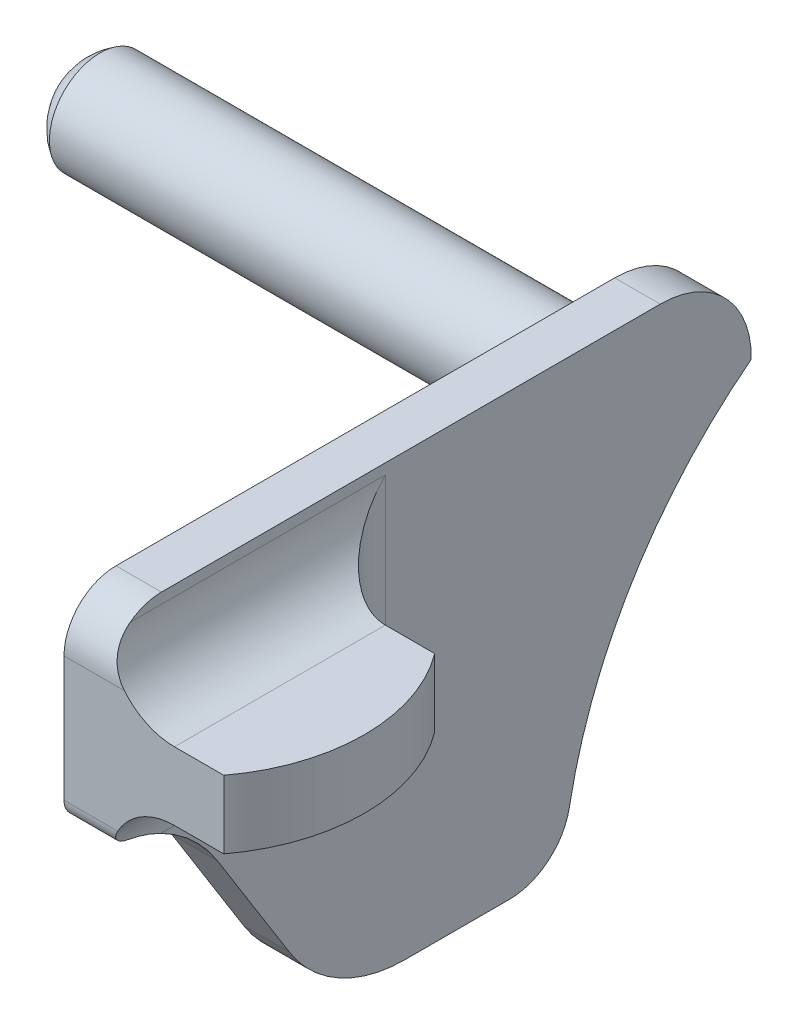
SolidWorks part; units mm, degrees
ref_plane "Front Plane" through (0, 0, 0) normal (0, 0, 1) x (1, 0, 0)
ref_plane "Top Plane" through (0, 0, 0) normal (0, 1, 0) x (1, 0, 0)
ref_plane "Right Plane" through (0, 0, 0) normal (1, 0, 0) x (0, 0, -1)
sketch "Sketch1" plane through (0, 0, 0) normal (1, 0, 0) x (0, 0, -1)
  line L0 (-10.3629, 13.4021) -> (9.1281, 13.4021)
  line L1 (-0.8375, -3.7986) -> (3.2309, -3.7986)
  line L2 (-8.1859, 3.2297) -> (-5.361, -1.2912)
  line L3 (-12.3949, 11.3701) -> (-12.3949, 6.4857)
  arc A0 (12.6829, 9.7533) -> (5.578, -1.8486) centre (24.3053, -5.3405) ccw
  arc A1 (11.7637, 12.2333) -> (3.7027, 1.1142) centre (24.3053, -5.3405) ccw construction
  arc A2 (9.1281, 13.4021) -> (12.6827, 9.7459) centre (9.1281, 9.8461) cw
  arc A3 (-8.1859, 3.2297) -> (-11.7879, 5.7396) centre (-12.9248, 0.2685) ccw
  arc A4 (5.578, -1.8486) -> (3.2309, -3.7986) centre (3.2309, -1.411) cw
  arc A5 (-0.8375, -3.7986) -> (-5.361, -1.2912) centre (-0.8375, 1.5354) cw
  arc A6 (-12.3949, 6.4857) -> (-11.7879, 5.7396) centre (-11.6329, 6.4857) ccw
  arc A7 (-10.3629, 13.4021) -> (-12.3949, 11.3701) centre (-10.3629, 11.3701) ccw
  arc A8 (-3.1462, 0.572) -> (0.6866, -3.1232) centre (0, 0) ccw construction
  arc A9 (1.0196, 3.0308) -> (-3.1462, 0.572) centre (-1.6268, 2.7561) ccw construction
  arc A10 (0.6866, -3.1232) -> (2.622, 1.8305) centre (1.7368, -0.6785) ccw construction
  circle A11 centre (8.8271, 9.2804) radius 1.9787 construction
  arc A12 (2.622, 1.8305) -> (1.0196, 3.0308) centre (0, 0) ccw construction
  arc A13 (2.8315, -3.1035) -> (2.7704, -3.7986) centre (24.3053, -5.3405) ccw
  dimension "D3" = 3.556
  dimension "D4" = 58
  dimension "D1" = 38.1
  dimension "D2" = 43.18
  dimension "D5" = 11.176
  dimension "D6" = 2.3876
  dimension "D7" = 5.334
  dimension "D8" = 0.762
  dimension "D9" = 2.032
extrude "Boss-Extrude1" add sketch "Sketch1" along normal blind 1.778
sketch "Sketch2" plane through (1.778, 0, 0) normal (1, 0, 0) x (0, 0, -1)
  line L4 (-0.8375, -3.7986) -> (3.2309, -3.7986)
  line L5 (9.1281, 13.4021) -> (-10.3629, 13.4021)
  line L6 (-12.3949, 11.3701) -> (-12.3949, 6.4857)
  line L7 (-8.1859, 3.2297) -> (-5.361, -1.2912)
  line L8 (-0.8375, -3.7986) -> (3.2309, -3.7986)
  line L9 (9.1281, 13.4021) -> (-10.3629, 13.4021)
  line L10 (-12.3949, 11.3701) -> (-12.3949, 6.4857)
  line L11 (-8.1859, 3.2297) -> (-5.361, -1.2912)
  arc A0 (2.7037, 1.8002) -> (2.622, 1.8305) centre (1.7368, -0.6785) ccw
  arc A4 (3.2482, -0.0033) -> (-2.3139, 2.2796) centre (0, 0) ccw
  arc A7 (3.2309, -3.7986) -> (5.578, -1.8486) centre (3.2309, -1.411) ccw
  arc A8 (12.6829, 9.7533) -> (5.578, -1.8486) centre (24.3053, -5.3405) ccw
  arc A9 (12.6829, 9.7533) -> (9.1281, 13.4021) centre (9.1281, 9.8461) ccw
  arc A10 (-10.3629, 13.4021) -> (-12.3949, 11.3701) centre (-10.3629, 11.3701) ccw
  arc A11 (-12.3949, 6.4857) -> (-11.7879, 5.7396) centre (-11.6329, 6.4857) ccw
  arc A12 (-8.1859, 3.2297) -> (-11.7879, 5.7396) centre (-12.9248, 0.2685) ccw
  arc A13 (-5.361, -1.2912) -> (-0.8375, -3.7986) centre (-0.8375, 1.5354) ccw
  arc A14 (3.2309, -3.7986) -> (5.578, -1.8486) centre (3.2309, -1.411) ccw
  arc A15 (12.6829, 9.7533) -> (5.578, -1.8486) centre (24.3053, -5.3405) ccw
  arc A16 (12.6829, 9.7533) -> (9.1281, 13.4021) centre (9.1281, 9.8461) ccw
  arc A17 (-10.3629, 13.4021) -> (-12.3949, 11.3701) centre (-10.3629, 11.3701) ccw
  arc A18 (-12.3949, 6.4857) -> (-11.7879, 5.7396) centre (-11.6329, 6.4857) ccw
  arc A19 (-8.1859, 3.2297) -> (-11.7879, 5.7396) centre (-12.9248, 0.2685) ccw
  arc A20 (-5.361, -1.2912) -> (-0.8375, -3.7986) centre (-0.8375, 1.5354) ccw
  arc A22 (3.2482, -0.0033) -> (1.2958, -1.3635) centre (6.7283, -7.0801) ccw
  arc A23 (-1.8801, -0.0585) -> (1.2958, -1.3635) centre (0, 0) ccw
  arc A24 (-1.8801, -0.0585) -> (-2.3139, 2.2796) centre (-9.7096, -0.3019) ccw
  dimension "D1" = 0
extrude "Boss-Extrude2" add sketch "Sketch2" against normal blind 3.5306 contours A23 A22 A4 A24
sketch "Sketch3" plane through (0, 0, 0) normal (-1, 0, 0) x (0, 0, 1)
  line L0 (0, 0) -> (18.4927, 0) construction
  line L1 (0, 0) -> (22.6326, 18.991) construction
  line L2 (22.6326, 18.991) -> (26.4118, 14.487) construction
  line L3 (1.9924, 1.0418) -> (-1.0825, -1.5383)
  arc A3 (-1.2958, -1.3635) -> (1.8801, -0.0585) centre (0, 0) ccw construction
  arc A4 (-1.0825, -1.5383) -> (1.8801, -0.0585) centre (0, 0) ccw
  arc A5 (1.9924, 1.0418) -> (1.8801, -0.0585) centre (9.7096, -0.3019) ccw
  dimension "D1" = 40
  dimension "D2" = 0.4826
sketch3d "3DSketch1"
  line L0 (0, 14.487, 26.4118) -> (-9.1625, 14.487, 26.4118) construction
ref_plane "Plane1" through (0, 18.991, 22.6326) normal (0, -0.6428, -0.766) x (-1, 0, 0)
sketch "Sketch4" plane through (-1.7526, 0, 0) normal (-1, 0, 0) x (0, 0, 1)
  circle A0 centre (0, 0) radius 3.1978
sketch "Sketch5" plane through (1.778, 0, 0) normal (1, 0, 0) x (0, 0, -1)
  arc A0 (2.9335, -0.9984) -> (-2.7926, 1.3432) centre (0, 0) ccw
  arc A1 (2.9335, -0.9984) -> (0.8477, -2.9806) centre (6.474, -6.8125) ccw
  arc A2 (-2.7006, -1.5196) -> (-2.7926, 1.3432) centre (-9.398, -0.3019) ccw
  arc A3 (-2.7006, -1.5196) -> (0.8477, -2.9806) centre (0, 0) ccw
  dimension "D1" = 6.1976
  dimension "D2" = 9.398
  dimension "D3" = 13.6144
  dimension "D4" = 9.398
extrude "Boss-Extrude3" add sketch "Sketch5" against normal blind 9.5758
sketch "Sketch6" plane through (0, 18.991, 22.6326) normal (0, -0.6428, -0.766) x (-1, 0, 0)
  line L0 (3.302, -1.7632) -> (3.302, -4.6755) construction
  line L1 (0, -3.4482) -> (0, -0.8331) construction
  line L2 (1.7526, -2.4149) -> (1.7526, -5.4494) construction
  line L3 (0, -3.4482) -> (0, -4.6961) construction
  dimension "D1" = 3.302
  dimension "D2" = 1.7526
sketch "Sketch8" plane through (0, 0, 0) normal (-1, 0, 0) x (0, 0, 1)
  line L1 (0, 0) -> (13.6415, 0) construction
  line L2 (0, 0) -> (22.6326, 18.991) construction
  line L3 (0, 0) -> (22.6326, 18.991) construction
  line L4 (2.6551, 1.5979) -> (-1.6474, -2.0123)
  arc A0 (-0.8477, -2.9806) -> (2.7006, -1.5196) centre (0, 0) ccw construction
  arc A1 (-0.8477, -2.9806) -> (2.7006, -1.5196) centre (0, 0) ccw
  arc A2 (2.7926, 1.3432) -> (2.7006, -1.5196) centre (9.398, -0.3019) ccw construction
  arc A3 (2.7926, 1.3432) -> (2.7006, -1.5196) centre (9.398, -0.3019) ccw
  arc A4 (-0.8477, -2.9806) -> (-2.9335, -0.9984) centre (-6.474, -6.8125) ccw construction
  arc A5 (-0.8477, -2.9806) -> (-1.6474, -2.0123) centre (-6.474, -6.8125) ccw
  arc A6 (2.7926, 1.3432) -> (2.2601, 2.12) centre (0, 0) ccw construction
  arc A7 (2.7926, 1.3432) -> (2.6551, 1.5979) centre (0, 0) ccw
  dimension "D1" = 0.4826
extrude "Cut-Extrude1" cut sketch "Sketch8" along normal blind 1.7526
sketch "Sketch10" plane through (-7.7978, 0, 0) normal (-1, 0, 0) x (0, 0, 1)
  line L0 (2.6045, 0.1297) -> (-0.9418, -2.846)
  line L1 (0, 0) -> (22.6326, 18.991) construction
  arc A0 (-0.8477, -2.9806) -> (2.7006, -1.5196) centre (0, 0) ccw construction
  arc A1 (-0.8477, -2.9806) -> (2.7006, -1.5196) centre (0, 0) ccw
  arc A2 (2.7926, 1.3432) -> (2.7006, -1.5196) centre (9.398, -0.3019) ccw construction
  arc A3 (2.6045, 0.1297) -> (2.7006, -1.5196) centre (9.398, -0.3019) ccw
  arc A4 (-0.8477, -2.9806) -> (-2.9335, -0.9984) centre (-6.474, -6.8125) ccw construction
  arc A5 (-0.8477, -2.9806) -> (-0.9418, -2.846) centre (-6.474, -6.8125) ccw
  dimension "D1" = 1.5748
sketch3d "3DSketch3"
  line L0 (-7.7978, 0.1297, 2.6045) -> (-5.842, 0.1297, 2.6045)
  line L1 (-3.302, -2.4103, 2.6045) -> (-3.302, -2.4812, 2.6045)
  line L2 (-3.302, -2.4812, 2.6045) -> (-7.7978, -2.4812, 2.6045)
  line L3 (-7.7978, 0.1297, 2.6045) -> (-7.7978, -2.4812, 2.6045)
  arc A0 (-5.842, 0.1297, 2.6045) -> (-3.302, -2.4103, 2.6045) centre (-5.842, -2.4103, 2.6045) ccw
  point P8 (-3.302, 0.1297, 2.6045)
  point P9 (-5.842, -2.4103, 0.0645)
  dimension "D2" = 2.54
  dimension "D1" = 3.302
sketch "Sketch11" plane through (0, 18.991, 22.6326) normal (0, -0.6428, -0.766) x (-1, 0, 0)
  line L0 (3.302, -3.5748) -> (7.7978, -3.5748) construction
  line L1 (3.302, -3.5748) -> (7.7978, -3.5748)
  line L2 (7.7978, -1.5748) -> (5.842, -1.5748) construction
  line L3 (7.7978, -1.5748) -> (5.842, -1.5748)
  line L4 (7.7978, -1.5748) -> (7.7978, -3.5748)
  ellipse E0 centre (5.842, -3.5206) end of major axis (8.382, -3.5206) minor radius 1.9458 (5.842, -1.5748) -> (3.302, -3.5206) ccw construction
  ellipse E1 centre (5.842, -3.5206) end of major axis (8.382, -3.5206) minor radius 1.9458 (5.842, -1.5748) -> (3.303, -3.5748) ccw
extrude "Cut-Extrude6" cut sketch "Sketch11" along normal through all contours L3 E1 L1 L4
sketch3d "3DSketch4"
  line L0 (0, 9.2804, -8.8271) -> (-20.955, 9.2804, -8.8271) construction
  line L1 (-20.955, 9.2804, -8.8271) -> (-20.955, 5.515, -8.8271) construction
  line L2 (-18.669, 9.2804, -8.8271) -> (-18.669, 6.9944, -8.8271) construction
  line L3 (-18.669, 9.2804, -8.8271) -> (-18.669, 11.5664, -8.8271) construction
  circle A0 centre (-18.669, 9.2804, -8.8271) radius 2.286
  point P6 (-18.669, 9.2804, -6.5411)
  dimension "D2" = 4.572
  dimension "D1" = 20.955
ref_plane "Plane2" through (0, 0, -8.8271) normal (0, 0, 1) x (1, 0, 0)
sketch "Sketch13" plane through (0, 0, -8.8271) normal (0, 0, 1) x (1, 0, 0)
  line L1 (-18.669, 6.9944) -> (-18.669, 11.5664) construction
  line L2 (-18.669, 6.9944) -> (-18.669, 11.5664)
  circle A0 centre (-18.669, 9.2804) radius 2.286 construction
  arc A1 (-18.669, 11.5664) -> (-18.669, 6.9944) centre (-18.669, 9.2804) ccw
revolve "Revolve1" add sketch "Sketch13" angle 90 about L1
sketch "Sketch14" plane through (0, 0, 0) normal (-1, 0, 0) x (0, 0, 1)
  circle A0 centre (-8.8271, 9.2804) radius 1.9787 construction
  circle A1 centre (-8.8271, 9.2804) radius 1.9787
extrude "Boss-Extrude4" add sketch "Sketch14" along normal up to surface (18.669 mm away)
sketch "Sketch15" plane through (0, 0, 0) normal (-1, 0, 0) x (0, 0, 1)
  circle A0 centre (-8.8271, 9.2804) radius 1.9787 construction
  circle A1 centre (-8.8271, 9.2804) radius 1.9787
  circle A2 centre (-8.8271, 9.2804) radius 2.6186
extrude "Cut-Extrude8" cut sketch "Sketch15" along normal up to vertex
sketch "Sketch17" plane through (-7.7978, 0, 0) normal (-1, 0, 0) x (0, 0, 1)
  line L0 (0, 0) -> (17.438, 0) construction
  line L1 (0, 0) -> (11.2328, -10.2211) construction
  line L2 (11.2328, -10.2211) -> (9.063, -12.6057) construction
  line L3 (0, 0) -> (4.6913, 5.1556) construction
  dimension "D1" = 42.3
sketch3d "3DSketch5"
  line L0 (-7.7978, 5.1556, 4.6913) -> (-5.2276, 5.1556, 4.6913) construction
ref_plane "Plane3" through (0, 0, 0) normal (0, 0.673, -0.7396) x (-1, 0, 0)
sketch "Sketch18" plane through (0, 0, 0) normal (0, 0.673, -0.7396) x (-1, 0, 0)
  line L2 (0, 0) -> (11.0801, 0) construction
  line L3 (7.9957, 1.4732) -> (6.096, 1.4732)
  line L4 (3.4777, 3.2921) -> (7.9957, 3.2921)
  line L5 (7.9957, 3.2921) -> (7.9957, 1.4732)
  arc A0 (3.4777, 3.2921) -> (6.096, 1.4732) centre (6.096, 4.2672) ccw
  dimension "D2" = 5.588
  dimension "D3" = 1.4732
extrude "Cut-Extrude9" cut sketch "Sketch18" along normal blind 6.096
sketch "Sketch19" plane through (0, 0, 0) normal (0, 0.673, -0.7396) x (-1, 0, 0)
  line L3 (7.7978, 1.4732) -> (7.7978, 3.0988)
  line L4 (7.7978, 3.0988) -> (3.558, 3.0988)
  line L5 (6.096, 1.4732) -> (7.7978, 1.4732)
  line L6 (7.7978, 1.4732) -> (7.7978, 3.0988)
  line L7 (7.7978, 3.0988) -> (3.558, 3.0988)
  line L8 (6.096, 1.4732) -> (7.7978, 1.4732)
  arc A1 (3.558, 3.0988) -> (6.096, 1.4732) centre (6.096, 4.2672) ccw
  arc A2 (3.558, 3.0988) -> (6.096, 1.4732) centre (6.096, 4.2672) ccw
  dimension "D1" = 0
extrude "Cut-Extrude10" cut sketch "Sketch19" against normal blind 6.096
sketch "Sketch20" plane through (1.778, 0, 0) normal (1, 0, 0) x (0, 0, -1)
sketch "Sketch21" plane through (1.778, 0, 0) normal (1, 0, 0) x (0, 0, -1)
  line L0 (-12.3949, 11.3701) -> (-12.3949, 6.4857) construction
  line L1 (-12.3949, 10.4501) -> (-4.1544, 10.4501)
  line L2 (-12.3949, 10.4501) -> (-12.3949, 7.789)
  line L3 (-12.3949, 7.789) -> (-4.1544, 7.789)
  line L4 (-4.1544, 10.4501) -> (-4.1544, 7.789)
extrude "Boss-Extrude5" add sketch "Sketch21" along normal blind 5.842
fillet "Fillet1" radius 2.54 3 edges at (1.778, 9.1196, 4.1544)
sketch "Sketch22" plane through (0, 10.4501, 0) normal (0, 1, 0) x (1, 0, 0)
  line L0 (7.62, -8.2746) -> (-2.4479, -8.2746) construction
  line L1 (7.62, -4.1544) -> (7.62, -12.3949) construction
  line L2 (7.62, -4.1544) -> (7.62, -8.2746) construction
  line L3 (7.62, -4.1544) -> (6.2443, -4.1544)
  line L4 (7.62, -8.2746) -> (7.62, -4.1544)
  arc A0 (7.62, -8.2746) -> (6.2443, -4.1544) centre (0.762, -8.2746) ccw
  dimension "D1" = 13.716
extrude "Cut-Extrude14" cut sketch "Sketch22" against normal blind 5.842
sketch "Sketch23" plane through (0, 10.4501, 0) normal (0, 1, 0) x (1, 0, 0)
  line L1 (7.62, -8.2746) -> (7.62, -4.1544) construction
  line L3 (7.62, -12.3949) -> (7.62, -8.2746)
  line L6 (7.62, -8.2746) -> (3.9428, -8.2746) construction
  line L7 (7.62, -12.3949) -> (6.2443, -12.3949)
  arc A0 (7.62, -8.2746) -> (6.2443, -4.1544) centre (0.762, -8.2746) ccw construction
  arc A1 (6.2443, -12.3949) -> (7.62, -8.2746) centre (0.762, -8.2746) ccw
extrude "Cut-Extrude15" cut sketch "Sketch23" against normal blind 5.842
sketch "Sketch25" plane through (0, 0, 0) normal (-1, 0, 0) x (0, 0, 1)
  line L0 (2.6551, 1.5979) -> (2.7831, 1.6749)
  line L1 (-2.9335, -0.9984) -> (-3.0909, -0.9984)
  arc A0 (2.6551, 1.5979) -> (2.2601, 2.12) centre (0, 0) ccw construction
  arc A1 (2.3139, 2.2796) -> (-3.2482, -0.0033) centre (0, 0) ccw construction
  arc A2 (-3.0978, -0.0793) -> (-2.9335, -0.9984) centre (0, 0) ccw construction
  arc A3 (2.2601, 2.12) -> (-3.0978, -0.0793) centre (0, 0) ccw construction
  arc A4 (2.6551, 1.5979) -> (2.2601, 2.12) centre (0, 0) ccw
  arc A5 (2.3139, 2.2796) -> (-3.2482, -0.0033) centre (0, 0) ccw
  arc A6 (-3.0978, -0.0793) -> (-2.9335, -0.9984) centre (0, 0) ccw
  arc A7 (2.2601, 2.12) -> (-3.0978, -0.0793) centre (0, 0) ccw
  arc A8 (2.7831, 1.6749) -> (-3.0909, -0.9984) centre (0, 0) ccw
extrude "Boss-Extrude6" add sketch "Sketch25" along normal blind 3.556 contours A7 M18 M17 M16 | L0 A8 M18 M19 | A8 L1 M16 M15
